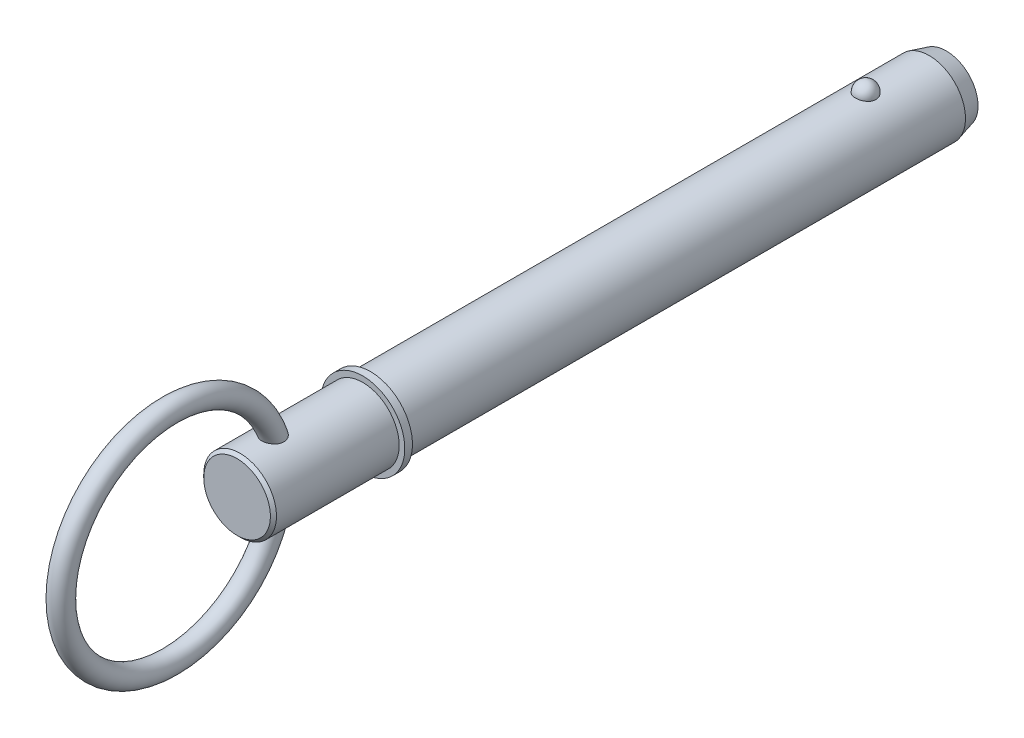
SolidWorks part; units mm, degrees
ref_plane "Front Plane" through (0, 0, 0) normal (0, 0, 1) x (1, 0, 0)
ref_plane "Top Plane" through (0, 0, 0) normal (0, 1, 0) x (1, 0, 0)
ref_plane "Right Plane" through (0, 0, 0) normal (1, 0, 0) x (0, 0, -1)
sketch "Sketch2" plane through (0, 0, 0) normal (0, 0, 1) x (1, 0, 0)
  circle A0 centre (0, 0) radius 9.525
  point P3 (0, 9.525)
  dimension "D1" = 19.05
extrude "Boss-Extrude1" add sketch "Sketch2" along normal blind 127
sketch "Sketch3" plane through (0, 0, 0) normal (0, 0, -1) x (-1, 0, 0)
  circle A0 centre (0, 0) radius 9.525
  dimension "D1" = 19.05
extrude "Boss-Extrude2" add sketch "Sketch3" along normal blind 23.8
chamfer "Chamfer1" distance 4.5 angle 15 1 edges at (-9.525, 0, -23.8)
sketch "Sketch18" plane through (0, 0, 0) normal (1, 0, 0) x (0, 0, -1)
  line L0 (19.3, 9.525) -> (-127, 9.525) construction
  line L1 (2.69, 12.215) -> (2.69, 6.835)
  line L2 (-127, -9.525) -> (19.3, -9.525) construction
  arc A0 (2.69, 12.215) -> (2.69, 6.835) centre (2.69, 9.525) ccw
  point P4 (0, 9.525)
  dimension "D1" = 21.74
revolve "Revolve1" add sketch "Sketch18" angle 360 about L1
sketch "Sketch19" plane through (0, 0, 0) normal (1, 0, 0) x (0, 0, -1)
  line L0 (-33.7288, 0) -> (-46.4542, 0) construction
sketch "Sketch20" plane through (0, 0, 0) normal (1, 0, 0) x (0, 0, -1)
  line L0 (-127, 0) -> (-127, 11)
  line L1 (-127, 9.525) -> (-127, -9.525) construction
  line L2 (-127, 11) -> (-129, 11)
  line L3 (-129, 11) -> (-129, 0)
  line L4 (-33.7288, 0) -> (-46.4542, 0) construction
  line L5 (-129, 0) -> (-127, 0)
  dimension "D1" = 11
  dimension "D2" = 2
revolve "Revolve2" add sketch "Sketch20" angle 360 about L0
sketch "Sketch21" plane through (0, 0, 127) normal (0, 0, -1) x (-1, 0, 0)
  circle A0 centre (0, 0) radius 9.525
  dimension "D1" = 19.05
extrude "Boss-Extrude3" add sketch "Sketch21" against normal blind 34.93
chamfer "Chamfer2" distance 0.8 angle 45 1 edges at (-9.525, 0, 161.93)
sketch "Sketch23" plane through (0, 0, 0) normal (1, 0, 0) x (0, 0, -1)
  line L0 (-161.93, 8.725) -> (-161.93, -8.725) construction
  circle A0 centre (-179.505, 0) radius 28.575
  point P2 (-150.93, 0)
  dimension "D1" = 57.15
  dimension "D2" = 11
sketch "Sketch24" plane through (0, 0, 0) normal (0, 1, 0) x (1, 0, 0)
  circle A0 centre (0, -150.93) radius 2.75
  dimension "D1" = 5.5
sweep "Sweep1" add profiles "Sketch24" path "Sketch23"
